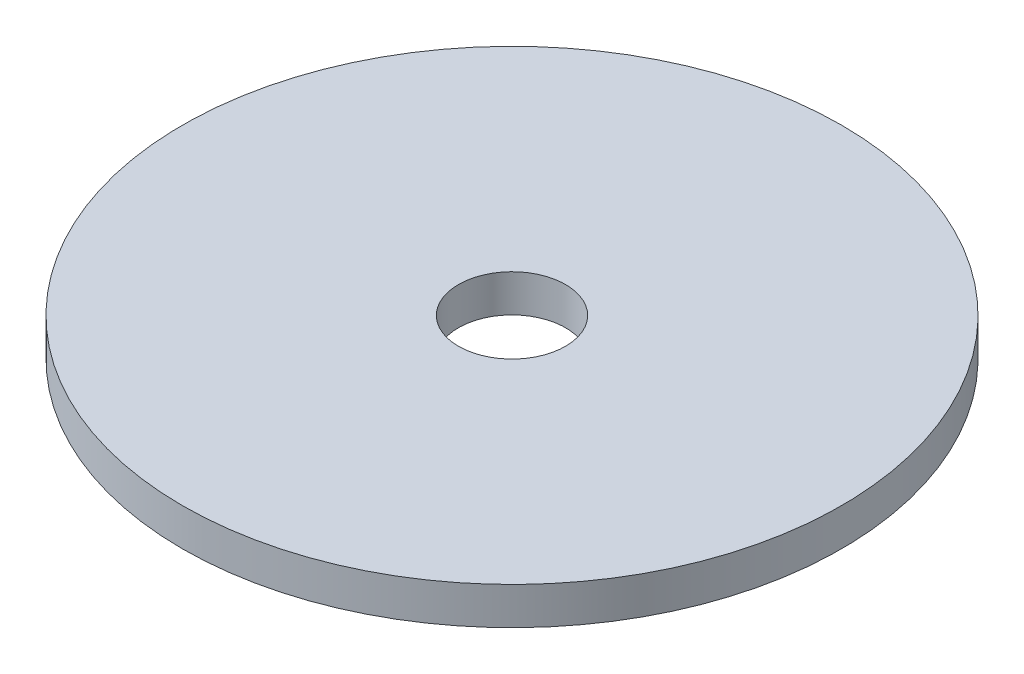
SolidWorks part; units mm, degrees
ref_plane "Front Plane" through (0, 0, 0) normal (0, 0, 1) x (1, 0, 0)
ref_plane "Top Plane" through (0, 0, 0) normal (0, 1, 0) x (1, 0, 0)
ref_plane "Right Plane" through (0, 0, 0) normal (1, 0, 0) x (0, 0, -1)
sketch "Sketch1" plane through (0, 0, 0) normal (0, 1, 0) x (1, 0, 0)
  circle A0 centre (0, 0) radius 15.875
  dimension "OD" = 31.75
extrude "Boss-Extrude1" add sketch "Sketch1" along normal blind 1.8034
sketch "Sketch5" plane through (0, 1.8034, 0) normal (0, 1, 0) x (-1, 0, 0)
  circle A0 centre (0, 0) radius 2.5781
  dimension "ID" = 5.1562
extrude "Cut-Extrude1" cut sketch "Sketch5" against normal through all
